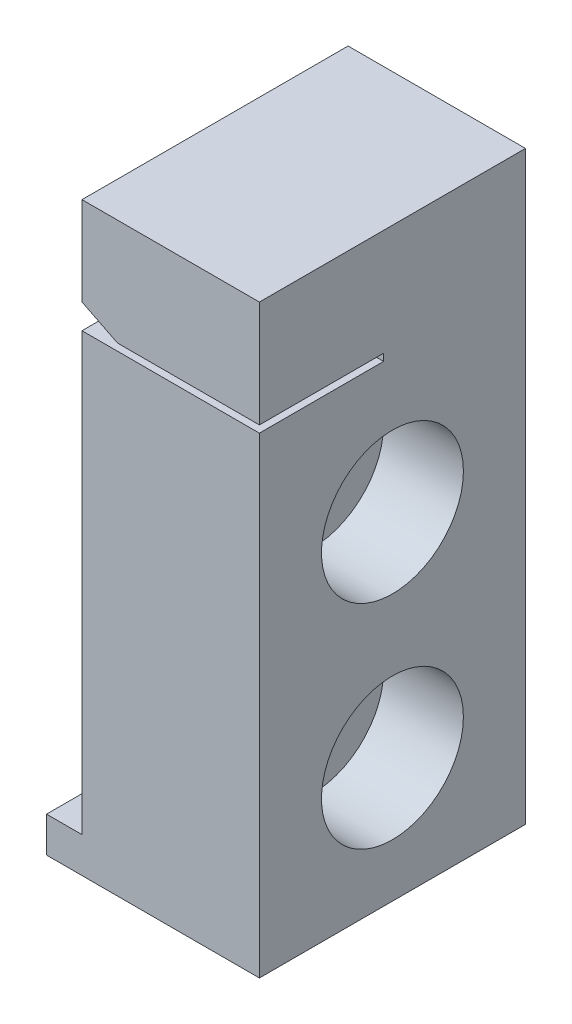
SolidWorks part; units mm, degrees
ref_plane "前视基准面" through (0, 0, 0) normal (0, 0, 1) x (1, 0, 0)
ref_plane "上视基准面" through (0, 0, 0) normal (0, 1, 0) x (1, 0, 0)
ref_plane "右视基准面" through (0, 0, 0) normal (1, 0, 0) x (0, 0, -1)
sketch "草图1" plane through (0, 0, 0) normal (0, 0, 1) x (1, 0, 0)
  line L0 (2, 2) -> (2, 33)
  line L1 (12, 0) -> (12, 33)
  line L2 (2, 33) -> (12, 33)
  line L3 (0, 0) -> (12, 0)
  line L4 (0, 0) -> (0, 2)
  line L5 (0, 2) -> (2, 2)
extrude "凸台-拉伸1" add sketch "草图1" along normal blind 15
sketch "草图2" plane through (12, 0, 0) normal (1, 0, 0) x (0, 0, -1)
  line L0 (0, 0) -> (0, 33)
  line L1 (-15, 0) -> (-15, 26.6)
  line L2 (-15, 0) -> (0, 0)
  line L3 (-15, 26.6) -> (-8, 26.6)
  line L4 (-15, 27) -> (-8, 27)
  line L5 (-15, 33) -> (0, 33)
  line L6 (-8, 26.6) -> (-8, 27)
  line L7 (-15, 27) -> (-15, 33)
  circle A0 centre (-7.5, 7) radius 2.25
  circle A1 centre (-7.5, 19) radius 2.25
extrude "切除-拉伸1" cut sketch "草图2" against normal through all flip side to cut
sketch "草图3" plane through (12, 0, 0) normal (1, 0, 0) x (0, 0, -1)
  circle A0 centre (-7.5, 7) radius 4
  circle A1 centre (-7.5, 19) radius 4
extrude "切除-拉伸2" cut sketch "草图3" against normal blind 4.5
sketch "草图4" plane through (0, 0, 15) normal (0, 0, 1) x (1, 0, 0)
  line L0 (2, 28) -> (4, 27)
  line L1 (2, 28) -> (2, 27)
  line L2 (2, 27) -> (4, 27)
extrude "切除-拉伸3" cut sketch "草图4" against normal up to surface (7 mm away)
